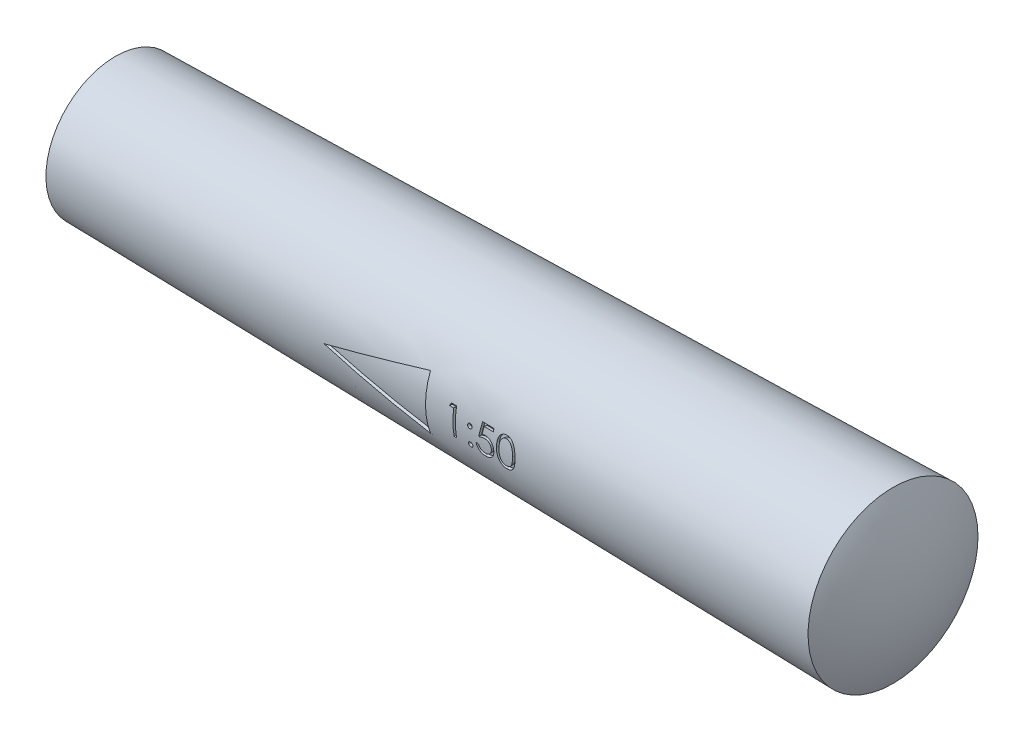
SolidWorks part; units mm, degrees
ref_plane "Front Plane" through (0, 0, 0) normal (0, 0, 1) x (1, 0, 0)
ref_plane "Top Plane" through (0, 0, 0) normal (0, 1, 0) x (1, 0, 0)
ref_plane "Right Plane" through (0, 0, 0) normal (1, 0, 0) x (0, 0, -1)
sketch "Sketch1" plane through (0, 0, 0) normal (1, 0, 0) x (0, 0, -1)
  circle A0 centre (0, 0) radius 2.5
  dimension "D1" = 5
extrude "Extrude1" add sketch "Sketch1" along normal mid plane 28
draft "Draft1" type of draft neutral plane draft angle 1.146 faces to draft 1 parameters "D1"=1.146
sketch "Sketch2" plane through (0, 0, 0) normal (0, 0, 1) x (1, 0, 0)
  line L0 (-14, 0) -> (-14, 2.5)
  line L1 (-14, 2.5) -> (-14, -2.5) construction
  line L2 (-14, 0) -> (-14.75, 0)
  line L3 (-14.75, 0) -> (-14.75, -2.78) construction
  line L4 (14, 0) -> (14, 3.06)
  line L5 (14, -3.06) -> (14, 3.06) construction
  line L6 (14, 0) -> (14.75, 0)
  line L7 (14.75, 0) -> (14.75, -2.78) construction
  line L8 (-14, -2.5) -> (14, -3.06) construction
  arc A0 (-14.75, 0) -> (-14, 2.5) centre (-10.2083, 0) cw
  arc A1 (14.75, 0) -> (14, 3.06) centre (8.1325, 0) ccw
  point P14 (0, -2.78)
revolve "Revolve1" add sketch "Sketch2" angle 360 about L2
sketch "Sketch5" plane through (0, 0, 0) normal (0, 0, 1) x (1, 0, 0)
  line L0 (0, 2.78) -> (0, -2.78) construction
  line L1 (14, 3.06) -> (-14, 2.5) construction
  line L2 (-14, -2.5) -> (14, -3.06) construction
ref_plane "Plane2" through (0, 0, 0) normal (-0.02, 0, 0.9998) x (0.9998, 0, 0.02)
sketch "Sketch6" plane through (0, 0, 0) normal (-0.02, 0, 0.9998) x (0.9998, 0, 0.02)
  line L0 (0, 0) -> (0, 1)
  line L1 (0, 2.78) -> (0, -2.78) construction
  line L2 (0, 1) -> (-3.7321, 0)
  line L3 (-3.7321, 0) -> (0, -1)
  line L4 (0, -1) -> (0, 0)
  line L5 (0, -0.5) -> (4, -0.5) construction
  text T0 "1:50" font "Century Gothic" height 1
  dimension "D1" = 2
  dimension "D2" = 30
  dimension "D3" = 4
wrap "Wrap2" sketch "Sketch6" wrap type deboss source sketch "Sketch6" thickness 0.1 parameters "D1"=0.1
equation "\"D2@Sketch2\" = \"D1@Sketch2\""
